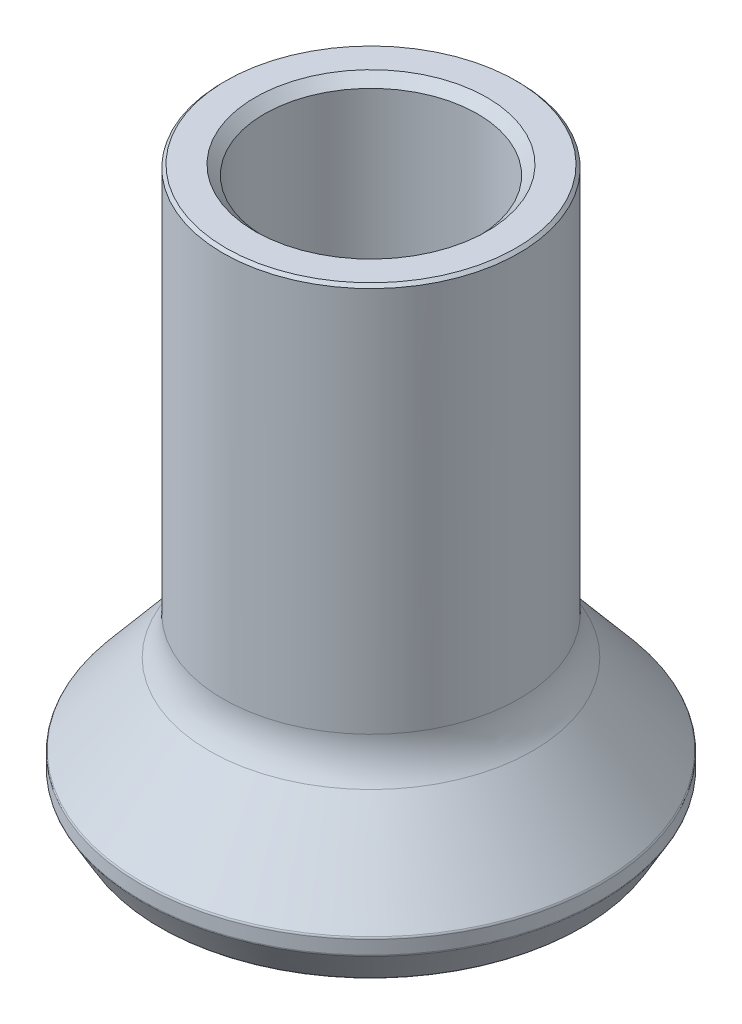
SolidWorks part; units mm, degrees
ref_plane "Спереди" through (0, 0, 0) normal (0, 0, 1) x (1, 0, 0)
ref_plane "Сверху" through (0, 0, 0) normal (0, 1, 0) x (1, 0, 0)
ref_plane "Справа" through (0, 0, 0) normal (1, 0, 0) x (0, 0, -1)
sketch "Эскиз1" plane through (0, 0, 0) normal (0, 0, 1) x (1, 0, 0)
  line L0 (0, 0) -> (0, 47) construction
  line L1 (17.7834, 0) -> (19.4, 2.8)
  line L2 (19.4, 2.8) -> (19.4, 4.1)
  line L3 (19.4, 4.1) -> (13.6698, 10.929)
  line L4 (12.5, 14.143) -> (12.5, 47)
  line L5 (12.5, 47) -> (9, 47)
  line L6 (9, 47) -> (9, 19.9)
  line L7 (9, 19.9) -> (4.4, 19.9)
  line L8 (4.4, 19.9) -> (4.4, 10.8)
  line L9 (4.4, 10.8) -> (7.05, 10.8)
  line L10 (7.05, 10.8) -> (7.05, 2.8)
  line L11 (7.05, 2.8) -> (15.9, 2.8)
  line L12 (15.9, 2.8) -> (17.2057, 0)
  line L13 (17.2057, 0) -> (17.7834, 0)
  arc A0 (13.6698, 10.929) -> (12.5, 14.143) centre (17.5, 14.143) cw
  point P19 (12.5, 12.3231)
  dimension "D17" = 5
  dimension "D1" = 25
  dimension "D2" = 38.8
  dimension "D3" = 18
  dimension "D4" = 14.1
  dimension "D5" = 8.8
  dimension "D6" = 31.8
  dimension "D7" = 0.5778
  dimension "D8" = 2.8
  dimension "D9" = 1.3
  dimension "D10" = 2.8
  dimension "D11" = 3.5
  dimension "D12" = 150
  dimension "D13" = 8
  dimension "D14" = 27.1
  dimension "D15" = 12.3231
  dimension "D16" = 47
  dimension "D18" = 40
  dimension "D19" = 34.6769
  dimension "D20" = 115
revolve "Повернуть1" add sketch "Эскиз1" angle 360 about L0
chamfer "Фаска1" distance 0.8 angle 45 1 edges at (0, 47, -9)
chamfer "Фаска2" distance 0.5 angle 45 2 edges at (0, 10.8, -4.4) (0, 2.8, -7.05)
fillet "Скругление1" [suppressed] radius 0.5
fillet "Скругление2" radius 0.25 5 edges at (0, 0, -17.2057) (0, 0, -17.7834) (0, 2.8, -19.4) (0, 4.1, -19.4) (0, 2.8, -15.9)
chamfer "Фаска3" distance 0.25 angle 45 1 edges at (0, 47, -12.5)
